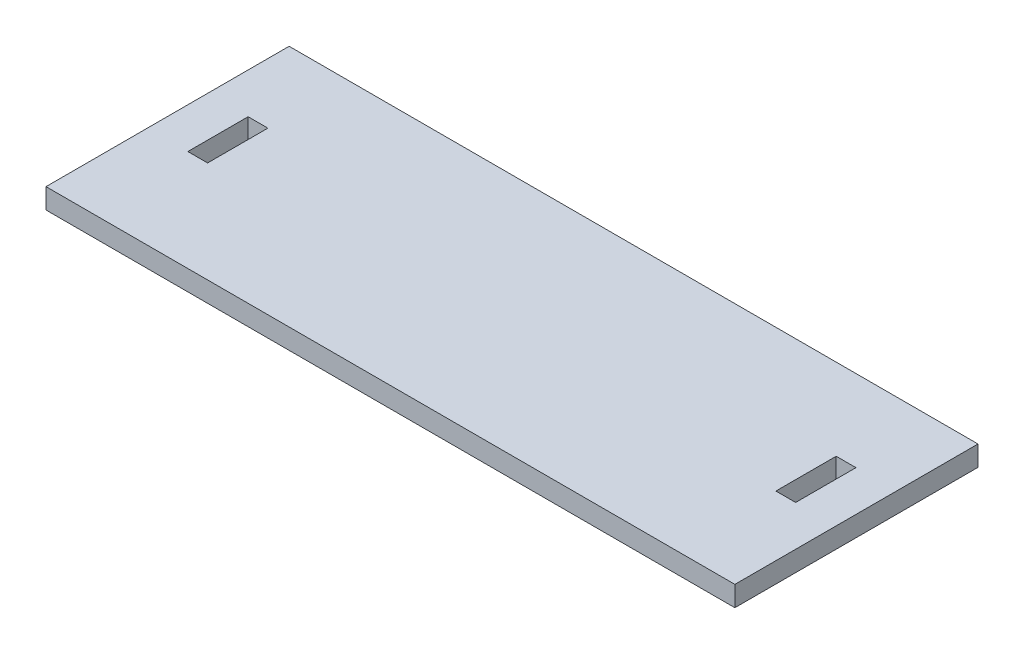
SolidWorks part; units mm, degrees
ref_plane "Front Plane" through (0, 0, 0) normal (0, 0, 1) x (1, 0, 0)
ref_plane "Top Plane" through (0, 0, 0) normal (0, 1, 0) x (1, 0, 0)
ref_plane "Right Plane" through (0, 0, 0) normal (1, 0, 0) x (0, 0, -1)
sketch "Sketch1" plane through (0, 0, 0) normal (0, 1, 0) x (1, 0, 0)
  line L0 (101.2384, 8.2175) -> (101.2384, -111.7825) construction
  line L1 (-68.7616, 8.2175) -> (271.2384, 8.2175)
  line L2 (-68.7616, 8.2175) -> (-68.7616, -111.7825)
  line L3 (-68.7616, -111.7825) -> (271.2384, -111.7825)
  line L4 (271.2384, 8.2175) -> (271.2384, -111.7825)
  line L5 (-48.7616, -32.0225) -> (-39.0016, -32.0225)
  line L6 (-48.7616, -32.0225) -> (-48.7616, -61.7825)
  line L7 (-48.7616, -61.7825) -> (-39.0016, -61.7825)
  line L8 (-39.0016, -32.0225) -> (-39.0016, -61.7825)
  line L9 (251.2384, -61.7825) -> (241.4784, -61.7825)
  line L10 (241.4784, -32.0225) -> (241.4784, -61.7825)
  line L11 (251.2384, -32.0225) -> (251.2384, -61.7825)
  line L12 (251.2384, -32.0225) -> (241.4784, -32.0225)
extrude "Boss-Extrude1" add sketch "Sketch1" along normal blind 10
equation "\"HeightHouse\" = \"SCALE\"*200mm"
equation "\"LenghtHouse\"=\"SCALE\"* 300mm"
equation "\"WidthHouse\"= \"SCALE\"*230mm"
equation "\"ThicknessMaterial\"=10mm"
equation "\"Kerf\"= 0.12mm"
equation "\"WidthWindows\"=\"SCALE\"* 45mm"
equation "\"WidthDoor\"=\"SCALE\"* 60mm"
equation "\"HeightDoor\"=\"SCALE\"* 80mm"
equation "\"LenghtJoints\" =\"SCALE\"* 30mm"
equation "\"HeightWindows\"=\"SCALE\"* 60"
equation "\"DistanceForJointsRoof\"=\"SCALE\"* 50mm"
equation "\"Roof1\"=\"SCALE\"* 115mm"
equation "\"Roof2\"=\"SCALE\"* 140mm"
equation "\"WidthWindowFrame\"=\"SCALE\"* 3mm"
equation "\"DistanceForJointsBody\"=\"SCALE\"* 35mm"
equation "\"CornerRoofBig\"=70deg"
equation "\"CornerRoofSmall\"= 60deg"
equation "\"D1@Sketch1\"=\"LenghtRoof\""
equation "\"D3@Sketch1\"=\"DistanceForJointsRoof\""
equation "\"D4@Sketch1\"=(\"LenghtRoof\"-\"LenghtHouse\")/2"
equation "\"LenghtRoof\"= \"LenghtHouse\"+(\"SCALE\"*40mm)"
equation "\"RoofSmall\"=\"SCALE\"* 120mm"
equation "\"RoofBig\"=\"SCALE\"* 170mm"
equation "\"D2@Sketch1\"=\"RoofSmall\""
equation "\"D1@Boss-Extrude1\"=\"ThicknessMaterial\""
equation "\"D5@Sketch1\"=\"LenghtJoints\"-\"Kerf\"*2"
equation "\"D6@Sketch1\"=\"ThicknessMaterial\"-\"Kerf\"*2"
